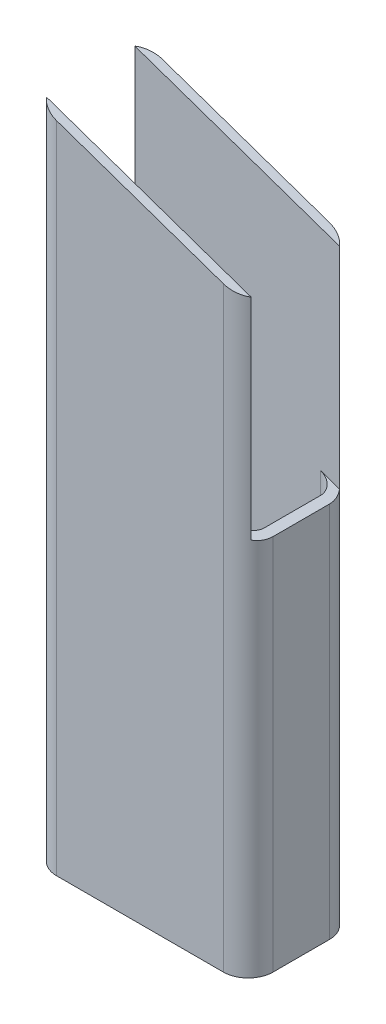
SolidWorks part; units mm, degrees
ref_plane "Alzado" through (0, 0, 0) normal (0, 0, 1) x (1, 0, 0)
ref_plane "Planta" through (0, 0, 0) normal (0, 1, 0) x (1, 0, 0)
ref_plane "Vista lateral" through (0, 0, 0) normal (1, 0, 0) x (0, 0, -1)
sketch "Croquis2" plane through (0, 0, 0) normal (0, 1, 0) x (1, 0, 0)
  line L0 (0, 222.285) -> (0, -222.285) construction
  line L1 (343.7936, 0) -> (-343.7936, 0) construction
  line L21 (-75.5, 40) -> (75.5, 40)
  line L23 (90, 25.5) -> (90, -25.5)
  line L40 (-75.5, 48) -> (75.5, 48)
  line L41 (98, 25.5) -> (98, -25.5)
  line L42 (-98, 25.5) -> (-98, -25.5)
  line L43 (-90, 25.5) -> (-90, -25.5)
  line L44 (90, 25.5) -> (90, -25.5)
  line L45 (98, 25.5) -> (98, -25.5)
  line L46 (-98, 25.5) -> (-98, -25.5)
  line L47 (-90, 25.5) -> (-90, -25.5)
  line L48 (90, 25.5) -> (90, -25.5)
  line L49 (98, 25.5) -> (98, -25.5)
  line L50 (-98, 25.5) -> (-98, -25.5)
  line L51 (-90, 25.5) -> (-90, -25.5)
  line L52 (90, 25.5) -> (90, -25.5)
  line L53 (98, 25.5) -> (98, -25.5)
  line L54 (-98, 25.5) -> (-98, -25.5)
  line L55 (-90, 25.5) -> (-90, -25.5)
  line L56 (-75.5, -48) -> (75.5, -48)
  line L57 (-75.5, -40) -> (75.5, -40)
  arc A49 (98, 25.5) -> (75.5, 48) centre (75.5, 25.5) ccw
  arc A50 (90, 25.5) -> (75.5, 40) centre (75.5, 25.5) ccw
  arc A51 (-90, 25.5) -> (-75.5, 40) centre (-75.5, 25.5) cw
  arc A52 (-98, 25.5) -> (-75.5, 48) centre (-75.5, 25.5) cw
  arc A53 (98, 25.5) -> (75.5, 48) centre (75.5, 25.5) ccw
  arc A54 (90, 25.5) -> (75.5, 40) centre (75.5, 25.5) ccw
  arc A55 (-90, 25.5) -> (-75.5, 40) centre (-75.5, 25.5) cw
  arc A56 (-98, 25.5) -> (-75.5, 48) centre (-75.5, 25.5) cw
  arc A57 (98, 25.5) -> (75.5, 48) centre (75.5, 25.5) ccw
  arc A58 (90, 25.5) -> (75.5, 40) centre (75.5, 25.5) ccw
  arc A59 (-90, 25.5) -> (-75.5, 40) centre (-75.5, 25.5) cw
  arc A60 (-98, 25.5) -> (-75.5, 48) centre (-75.5, 25.5) cw
  arc A61 (98, 25.5) -> (75.5, 48) centre (75.5, 25.5) ccw
  arc A62 (90, 25.5) -> (75.5, 40) centre (75.5, 25.5) ccw
  arc A63 (-90, 25.5) -> (-75.5, 40) centre (-75.5, 25.5) cw
  arc A64 (-98, 25.5) -> (-75.5, 48) centre (-75.5, 25.5) cw
  arc A65 (-98, -25.5) -> (-75.5, -48) centre (-75.5, -25.5) ccw
  arc A66 (-90, -25.5) -> (-75.5, -40) centre (-75.5, -25.5) ccw
  arc A67 (90, -25.5) -> (75.5, -40) centre (75.5, -25.5) cw
  arc A68 (98, -25.5) -> (75.5, -48) centre (75.5, -25.5) cw
  arc A69 (-98, -25.5) -> (-75.5, -48) centre (-75.5, -25.5) ccw
  arc A70 (-90, -25.5) -> (-75.5, -40) centre (-75.5, -25.5) ccw
  arc A71 (90, -25.5) -> (75.5, -40) centre (75.5, -25.5) cw
  arc A72 (98, -25.5) -> (75.5, -48) centre (75.5, -25.5) cw
  arc A73 (-98, -25.5) -> (-75.5, -48) centre (-75.5, -25.5) ccw
  arc A74 (-90, -25.5) -> (-75.5, -40) centre (-75.5, -25.5) ccw
  arc A75 (90, -25.5) -> (75.5, -40) centre (75.5, -25.5) cw
  arc A76 (98, -25.5) -> (75.5, -48) centre (75.5, -25.5) cw
  arc A77 (-98, -25.5) -> (-75.5, -48) centre (-75.5, -25.5) ccw
  arc A78 (-90, -25.5) -> (-75.5, -40) centre (-75.5, -25.5) ccw
  arc A79 (90, -25.5) -> (75.5, -40) centre (75.5, -25.5) cw
  arc A80 (98, -25.5) -> (75.5, -48) centre (75.5, -25.5) cw
  point P4 (0, 0)
  point P7 (0, 0)
  point P9 (0, -40)
  point P10 (-98, 0)
  point P12 (90, 0)
  point P22 (98, 0)
  point P23 (0, 48)
  point P24 (0, 40)
  point P34 (-90, 0)
  point P35 (0, -48)
  dimension "D3" = 8
  dimension "D4" = 22.5
  dimension "D1" = 48
  dimension "D2" = 98
extrude "Saliente-Extruir1" add sketch "Croquis2" along normal mid plane 600 contours A68 L41 A49 L40 A52 L42 A65 L56 L23 A67 L57 A66 L43 A51 L21 A50
sketch "Croquis12" plane through (0, 0, 48) normal (0, 0, 1) x (1, 0, 0)
  line L0 (-98, 300) -> (98, 300)
  line L1 (98, 232.0533) -> (-203.5773, 232.0533) construction
  line L2 (98, 300) -> (98, -300) construction
  line L3 (98, 232.0533) -> (-98, 300)
  line L4 (98, 300) -> (98, 232.0533)
  dimension "D1" = 19.12
extrude "Cortar-Extruir7" cut sketch "Croquis12" against normal through all
sketch "Croquis13" plane through (0, 0, 0) normal (0, 0, 1) x (1, 0, 0)
  line L0 (-98, 300) -> (-98, 109.49)
  line L1 (-98, 300) -> (-98, -300) construction
  line L2 (-98, 109.49) -> (98, 41.5433)
  line L3 (98, 232.0533) -> (98, -300) construction
  line L4 (98, 41.5433) -> (98, 232.0533)
  line L5 (98, 232.0533) -> (-98, 300)
  dimension "D1" = 190.51
extrude "Cortar-Extruir8" cut sketch "Croquis13" against normal mid plane 80
